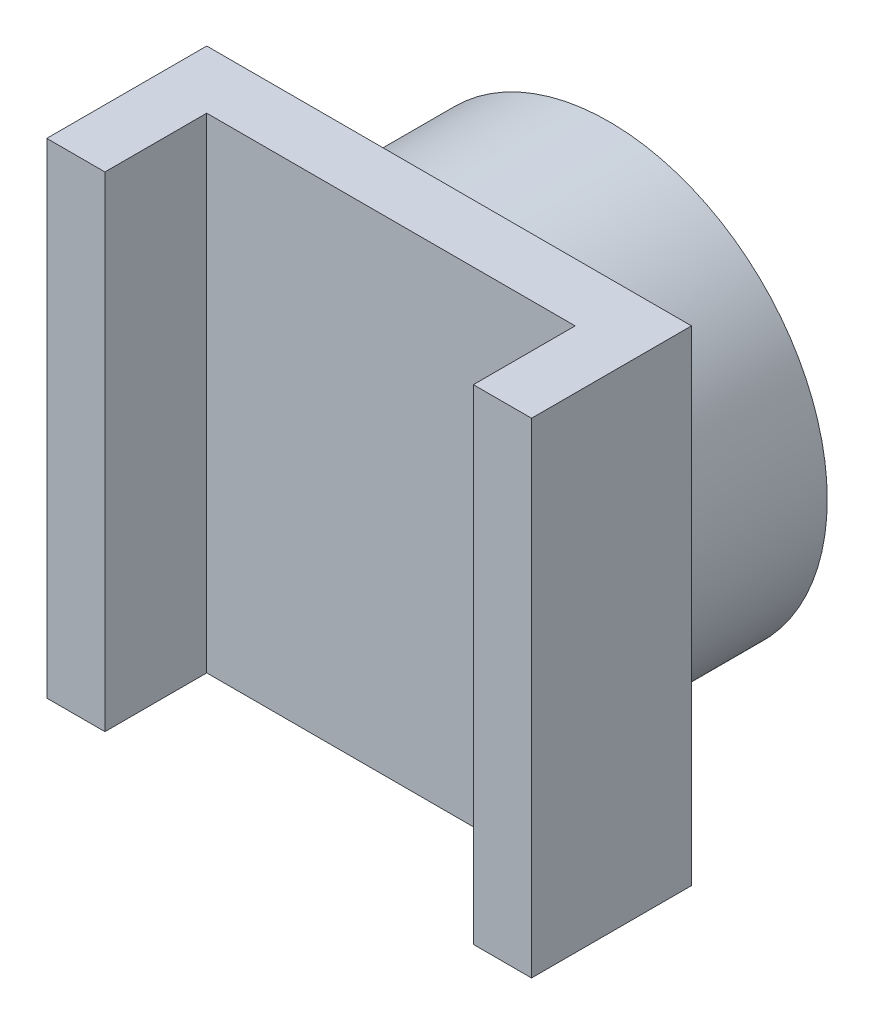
SolidWorks part; units mm, degrees
ref_plane "Plan de face" through (0, 0, 0) normal (0, 0, 1) x (1, 0, 0)
ref_plane "Plan de dessus" through (0, 0, 0) normal (0, 1, 0) x (1, 0, 0)
ref_plane "Plan de droite" through (0, 0, 0) normal (1, 0, 0) x (0, 0, -1)
sketch "Esquisse1" plane through (0, 0, 0) normal (0, 0, 1) x (1, 0, 0)
  line L1 (-20, 10) -> (20, 10)
  line L2 (-20, 10) -> (-20, -10)
  line L3 (-20, -10) -> (20, -10)
  line L4 (20, 10) -> (20, -10)
  dimension "D1" = 20
  dimension "D2" = 10
  dimension "D3" = 40
  dimension "D4" = 20
extrude "Extrusion1" add sketch "Esquisse1" along normal blind 36
sketch "Esquisse2" plane through (0, 0, 36) normal (0, 0, 1) x (1, 0, 0)
  line L0 (20, -10) -> (20, 10) construction
  circle A0 centre (10.2, 0) radius 6.5
  dimension "D1" = 13
  dimension "D2" = 9.8
extrude "Extrusion2" add sketch "Esquisse2" along normal blind 2
sketch "Esquisse3" plane through (0, 0, 38) normal (0, 0, 1) x (1, 0, 0)
  circle A0 centre (10.2, 0) radius 2.8
  dimension "D1" = 5.6
extrude "Extrusion3" add sketch "Esquisse3" along normal blind 3.3
ref_plane "Plan2" through (0, 0, 32.5) normal (0, 0, 1) x (1, 0, 0)
sketch "Esquisse5" plane through (0, 0, 32.5) normal (0, 0, 1) x (1, 0, 0)
  line L0 (20, -10) -> (20, 10) construction
  line L1 (20, 10) -> (26.35, 10)
  line L2 (20, 10) -> (20, -10)
  line L3 (20, -10) -> (26.35, -10)
  line L4 (26.35, 10) -> (26.35, -10)
  line L5 (20, 10) -> (-20, 10) construction
  line L6 (-20, -10) -> (20, -10) construction
  line L7 (-20, 10) -> (-20, -10) construction
  line L8 (-26.35, 10) -> (-20, 10)
  line L9 (-26.35, 10) -> (-26.35, -10)
  line L10 (-26.35, -10) -> (-20, -10)
  line L11 (-20, 10) -> (-20, -10)
  circle A0 centre (-23.85, 6.5) radius 1.6
  circle A1 centre (-23.85, -6.5) radius 1.55
  circle A2 centre (23.65, 6.5) radius 1.55
  circle A3 centre (23.65, -6.5) radius 1.55
  dimension "D5" = 3.1
  dimension "D6" = 3.2
  dimension "D7" = 3.1
  dimension "D8" = 3.1
  dimension "D1" = 52.7
  dimension "D2" = 6.35
  dimension "D3" = 13
  dimension "D4" = 6.5
  dimension "D9" = 47.5
  dimension "D10" = 3.85
extrude "Extrusion4" add sketch "Esquisse5" against normal blind 6
sketch "Esquisse6" plane through (0, 0, 0) normal (0, 0, -1) x (-1, 0, 0)
  line L0 (-35.2, 13.5) -> (-35.2, -13.5) construction
  line L1 (-35.2, 13.5) -> (-35.2, -13.5)
  line L2 (3.3, 130) -> (3.3, 180) construction
  line L3 (3.3, 25) -> (3.3, 180)
  arc A0 (-35.2, -13.5) -> (-35.2, 13.5) centre (-10.2, 0) ccw
  circle A1 centre (-10.2, 0) radius 25
sketch "Esquisse7" plane through (0, 0, 41.3) normal (0, 0, 1) x (1, 0, 0)
  circle A0 centre (10.2, 0) radius 4.5
  circle A1 centre (10.2, 0) radius 2.8
  circle A2 centre (10.2, 0) radius 2.8
  dimension "D2" = 9
  dimension "D1" = 0
extrude "Extrusion5" add sketch "Esquisse7" against normal up to surface (3.3 mm away)
ref_plane "Plan3" through (0, 0, 0) normal (0, -1, 0) x (0, 0, -1)
sketch "Esquisse8" plane through (0, 0, 0) normal (0, -1, 0) x (0, 0, -1)
  line L0 (-41.3, 10.2) -> (-41.3, 15.2)
  line L1 (-41.3, 14.7) -> (-41.3, 5.7) construction
  line L2 (-41.3, 15.2) -> (-44.6, 15.2)
  line L3 (-44.6, 15.2) -> (-44.6, 14)
  line L4 (-44.6, 14) -> (-42.5, 14)
  line L5 (-42.5, 14) -> (-42.5, 6.4)
  line L6 (-42.5, 6.4) -> (-44.6, 6.4)
  line L7 (-44.6, 6.4) -> (-44.6, 5.2)
  line L8 (-44.6, 5.2) -> (-41.3, 5.2)
  line L9 (-41.3, 5.2) -> (-41.3, 10.2)
  line L10 (-38, 10.2) -> (-41.3, 10.2) construction
  dimension "D1" = 10
  dimension "D2" = 5
  dimension "D3" = 1.2
  dimension "D4" = 1.2
  dimension "D5" = 1.2
  dimension "D6" = 3.3
extrude "Extrusion6" add sketch "Esquisse8" along normal mid plane 10
sketch "Esquisse9" plane through (0, 10, 0) normal (0, 1, 0) x (1, 0, 0)
  line L0 (3.7, -38) -> (16.7, -38) construction
  line L1 (3.7, -38) -> (16.7, -38)
  line L2 (3.7, -36) -> (3.7, -38) construction
  line L3 (3.7, -36) -> (3.7, -38)
  line L4 (16.7, -38) -> (16.7, -36)
  line L5 (16.7, -36) -> (20, -36)
  line L12 (20, 0) -> (-20, 0)
  line L13 (-20, 0) -> (-20, -26.5)
  line L14 (-20, -26.5) -> (-26.35, -26.5)
  line L15 (-26.35, -26.5) -> (-26.35, -32.5)
  line L16 (-26.35, -32.5) -> (-20, -32.5)
  line L17 (-20, -32.5) -> (-20, -36)
  line L18 (-20, -36) -> (20, -36)
  line L19 (20, -36) -> (20, -32.5)
  line L20 (20, -32.5) -> (26.35, -32.5)
  line L21 (26.35, -32.5) -> (26.35, -26.5)
  line L22 (26.35, -26.5) -> (20, -26.5)
  line L23 (20, -26.5) -> (20, 0)
  line L24 (20, 0) -> (-20, 0)
  line L25 (-20, 0) -> (-20, -26.5)
  line L26 (-20, -26.5) -> (-26.35, -26.5)
  line L27 (-26.35, -26.5) -> (-26.35, -32.5)
  line L28 (-26.35, -32.5) -> (-20, -32.5)
  line L29 (-20, -32.5) -> (-20, -36)
  line L30 (-20, -36) -> (3.7, -36)
  line L31 (20, -36) -> (20, -32.5)
  line L32 (20, -32.5) -> (26.35, -32.5)
  line L33 (26.35, -32.5) -> (26.35, -26.5)
  line L34 (26.35, -26.5) -> (20, -26.5)
  line L35 (20, -26.5) -> (20, 0)
  dimension "D1" = 0
extrude "Extrusion7" cut sketch "Esquisse9" against normal through all
sketch "Esquisse10" plane through (0, 0, 38) normal (0, 0, -1) x (-1, 0, 0)
  circle A0 centre (-10.0733, 0) radius 2.8
  dimension "D1" = 5.6
extrude "Extrusion8" cut sketch "Esquisse10" against normal up to surface (3.3 mm away)
